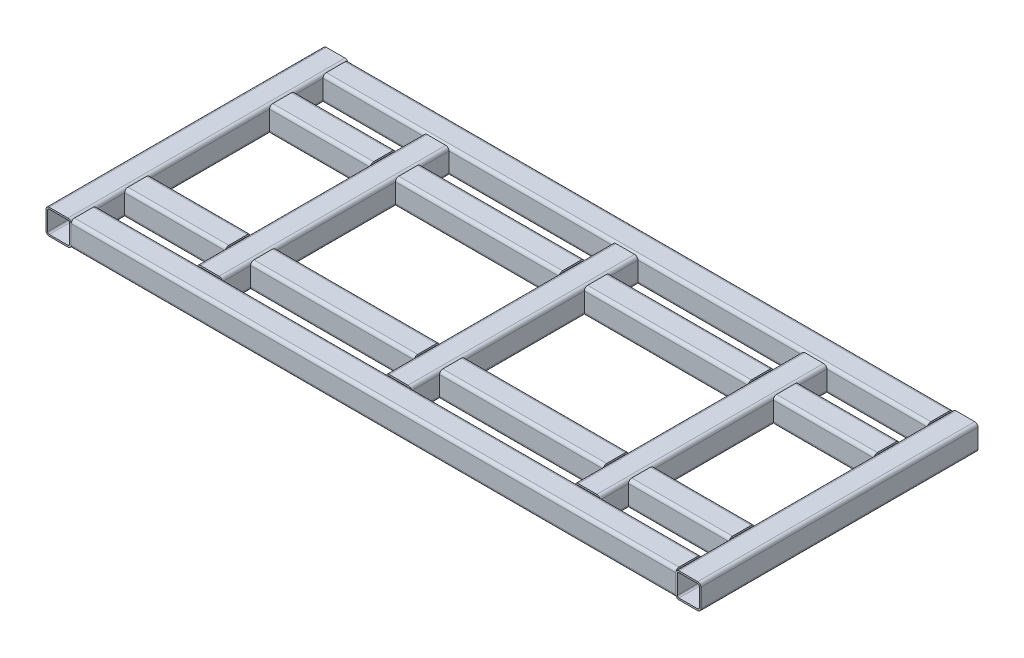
SolidWorks part; units mm, degrees
ref_plane "Front Plane" through (0, 0, 0) normal (0, 0, 1) x (1, 0, 0)
ref_plane "Top Plane" through (0, 0, 0) normal (0, 1, 0) x (1, 0, 0)
ref_plane "Right Plane" through (0, 0, 0) normal (1, 0, 0) x (0, 0, -1)
sketch "Sketch1" plane through (0, 0, 0) normal (0, 1, 0) x (1, 0, 0)
  line L0 (0, -115) -> (1000, -115)
  line L1 (0, 200) -> (1000, 200)
  line L2 (0, 200) -> (0, -200)
  line L3 (0, -200) -> (1000, -200)
  line L4 (1000, 200) -> (1000, -200)
  line L5 (0, 115) -> (1000, 115)
  line L6 (200, 200) -> (200, -200)
  line L7 (500, -200) -> (500, 200)
  line L8 (800, 200) -> (800, -200)
  line L9 (0, 0) -> (1000, 0) construction
  dimension "D1" = 1000
  dimension "D2" = 400
  dimension "D3" = 85
  dimension "D4" = 200
  dimension "D5" = 200
other "Structural Member1"
ref_plane "Plane3" through (0, 0, -200) normal (0, 0, 1) x (1, 0, 0)
sketch "Sketch13" plane through (0, 0, -200) normal (0, 0, 1) x (1, 0, 0)
  line L0 (-14.8, -17.4) -> (14.8, -17.4)
  line L1 (-17.4, -14.8) -> (-17.4, 14.8)
  line L2 (14.8, 17.4) -> (-14.8, 17.4)
  line L3 (17.4, 14.8) -> (17.4, -14.8)
  line L4 (-14.8, -20) -> (14.8, -20)
  line L5 (-20, -14.8) -> (-20, 14.8)
  line L6 (14.8, 20) -> (-14.8, 20)
  line L7 (20, 14.8) -> (20, -14.8)
  line L8 (-20, 0) -> (-17.4, 0) construction
  line L9 (-17.4, 0) -> (17.4, 0) construction
  line L10 (17.4, 0) -> (20, 0) construction
  line L12 (0, 20) -> (0, 17.4) construction
  line L13 (0, 17.4) -> (0, -17.4) construction
  line L14 (0, -17.4) -> (0, -20) construction
  arc A0 (20, 14.8) -> (14.8, 20) centre (14.8, 14.8) ccw
  arc A1 (14.8, -20) -> (20, -14.8) centre (14.8, -14.8) ccw
  arc A2 (-20, -14.8) -> (-14.8, -20) centre (-14.8, -14.8) ccw
  arc A3 (-14.8, 20) -> (-20, 14.8) centre (-14.8, 14.8) ccw
  arc A4 (-14.8, 17.4) -> (-17.4, 14.8) centre (-14.8, 14.8) ccw
  arc A5 (17.4, 14.8) -> (14.8, 17.4) centre (14.8, 14.8) ccw
  arc A6 (14.8, -17.4) -> (17.4, -14.8) centre (14.8, -14.8) ccw
  arc A7 (-17.4, -14.8) -> (-14.8, -17.4) centre (-14.8, -14.8) ccw
  point P2 (-20, 20)
  point P33 (-20, -20)
  point P34 (20, -20)
  point P36 (20, 20)
  point P37 (0, 0)
  dimension "D1" = 5.2
  dimension "Thickness" = 2.6
  dimension "V_leg" = 40
  dimension "H_leg" = 40
